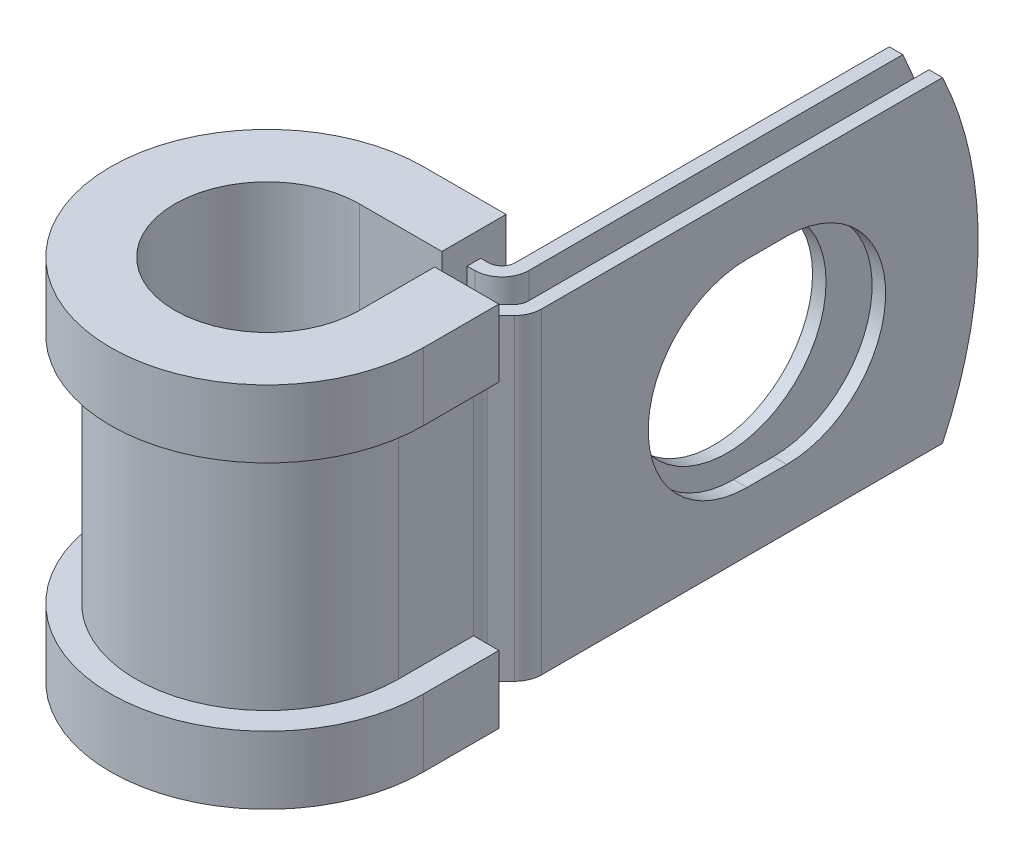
SolidWorks part; units mm, degrees
ref_plane "Front Plane" through (0, 0, 0) normal (0, 0, 1) x (1, 0, 0)
ref_plane "Top Plane" through (0, 0, 0) normal (0, 1, 0) x (1, 0, 0)
ref_plane "Right Plane" through (0, 0, 0) normal (1, 0, 0) x (0, 0, -1)
sketch "Sketch1" plane through (0, 0, 0) normal (0, 1, 0) x (1, 0, 0)
  line L0 (0, 7.0739) -> (5.4139, 7.0739)
  line L1 (7.0739, 0) -> (7.0739, 4.5235)
  line L2 (7.0395, 33.3248) -> (7.0395, 8.6995)
  line L3 (7.55, 5.673) -> (8.3762, 6.4992)
  line L5 (8.6143, 7.0739) -> (8.6143, 33.3248)
  arc A0 (0, 7.0739) -> (7.0739, 0) centre (0, 0) ccw
  arc A1 (7.55, 5.673) -> (7.0739, 4.5235) centre (8.6995, 4.5235) ccw
  arc A2 (8.3762, 6.4992) -> (8.6143, 7.0739) centre (7.8015, 7.0739) ccw
  arc A3 (5.4139, 7.0739) -> (7.0395, 8.6995) centre (5.4139, 8.6995) ccw
extrude "Extrude-Thin1" add sketch "Sketch1" along normal mid plane 19.05 thin
sketch "Sketch2" plane through (6.2267, 0, 0) normal (-1, 0, 0) x (0, 0, 1)
  line L0 (-33.3248, 9.525) -> (-33.3248, -9.525) construction
  line L1 (0, 9.525) -> (0, -9.525) construction
  circle A0 centre (-20.6248, 0) radius 5.9436
  point P2 (-33.3248, 0)
extrude "Cut-Extrude1" cut sketch "Sketch2" against normal up to surface (0.8128 mm away)
sketch "Sketch3" plane through (9.4271, 0, 0) normal (1, 0, 0) x (0, 0, -1)
  line L0 (19.431, 0) -> (21.8186, 0) construction
  line L1 (19.431, 5.9436) -> (21.8186, 5.9436)
  line L2 (19.431, -5.9436) -> (21.8186, -5.9436)
  line L3 (33.3248, 9.525) -> (33.3248, -9.525) construction
  arc A0 (19.431, 5.9436) -> (19.431, -5.9436) centre (19.431, 0) ccw
  arc A1 (21.8186, -5.9436) -> (21.8186, 5.9436) centre (21.8186, 0) ccw
  point P3 (20.6248, 0)
  point P8 (33.3248, 0)
  point P11 (13.4874, 0)
  point P12 (27.7622, 0)
extrude "Cut-Extrude2" cut sketch "Sketch3" against normal up to surface (0.8128 mm away)
sketch "Sketch4" plane through (6.2267, 0, 0) normal (-1, 0, 0) x (0, 0, 1)
  line L0 (-33.3248, 9.525) -> (-33.3248, -9.525)
  line L1 (-33.3248, 9.525) -> (-31.1803, 9.525)
  line L2 (-33.3248, 9.525) -> (-8.6995, 9.525) construction
  line L3 (-33.3248, -9.525) -> (-31.1803, -9.525)
  line L4 (-33.3248, -9.525) -> (-8.6995, -9.525) construction
  arc A0 (-31.1803, 9.525) -> (-31.1803, -9.525) centre (-11.0998, 0) ccw
extrude "Cut-Extrude3" cut sketch "Sketch4" against normal through all contours A0 M4 M5 | A0 L0 M2
ref_plane "Plane1" through (0, 0, -4.5235) normal (0, 0, -1) x (-1, 0, 0)
ref_plane "Plane2" through (4.9567, 0, 0) normal (-1, 0, 0) x (0, 0, 1)
sketch "Sketch5" plane through (0, 0, -4.5235) normal (0, 0, -1) x (-1, 0, 0)
  line L0 (-7.8867, 9.525) -> (-7.0739, 9.525)
  line L1 (-7.8867, 9.525) -> (-7.8867, -9.525) construction
  line L3 (-7.0739, 9.525) -> (-7.0739, -9.525)
  line L4 (-7.0739, -9.525) -> (-7.8867, -9.525)
  line L5 (-7.8867, -9.525) -> (-7.8867, -6.985)
  line L6 (-7.8867, 9.525) -> (-7.8867, 6.985)
  line L7 (-9.4107, 11.049) -> (-9.4107, 6.985)
  line L8 (-9.4107, 11.049) -> (-5.5499, 11.049)
  line L9 (-5.5499, 11.049) -> (-5.5499, -11.049)
  line L10 (-5.5499, -11.049) -> (-9.4107, -11.049)
  line L11 (-9.4107, -11.049) -> (-9.4107, -6.985)
  line L12 (-9.4107, 6.985) -> (-7.8867, 6.985)
  line L13 (-7.8867, -6.985) -> (-9.4107, -6.985)
sketch "Sketch6" plane through (0, 9.525, 0) normal (0, 1, 0) x (1, 0, 0)
  line L0 (5.5499, 0) -> (5.5499, 4.5235)
  line L1 (5.5499, 4.5235) -> (9.4107, 4.5235) construction
  line L2 (4.9567, 6.9878) -> (4.9567, -6.9878) construction
  line L5 (0, 5.5499) -> (4.9567, 5.5499)
  arc A0 (0, 5.5499) -> (5.5499, 0) centre (0, 0) ccw
sweep "Sweep1" add profiles "Sketch5" path "Sketch6"
equation "\"D4@Sketch5\" = \"D1@Extrude-Thin1\""
equation "\"D5@Sketch5\" = \"D5@Extrude-Thin1\""
equation "\"D1@Sketch3\" = \"D2@Sketch2\""
equation "\"D7@Sketch1\" = \"D3@Sketch2\" + \"D1@Sketch3\""
equation "\"D1@Sketch1\" = \"D1@Sketch6\" + 2 * \"D3@Sketch5\""
equation "\"D1@Sketch4\" = ( \"D1@Extrude-Thin1\" + .125 ) * 2"
equation "\"D9@Sketch1\"= \"D5@Extrude-Thin1\""
equation "\"D8@Sketch1\"= 2 * \"D5@Extrude-Thin1\""
equation "\"D2@Sketch1\" = 2 * \"D5@Extrude-Thin1\""
equation "\"D2@Sketch3\" = \"D1@Sketch2\""
